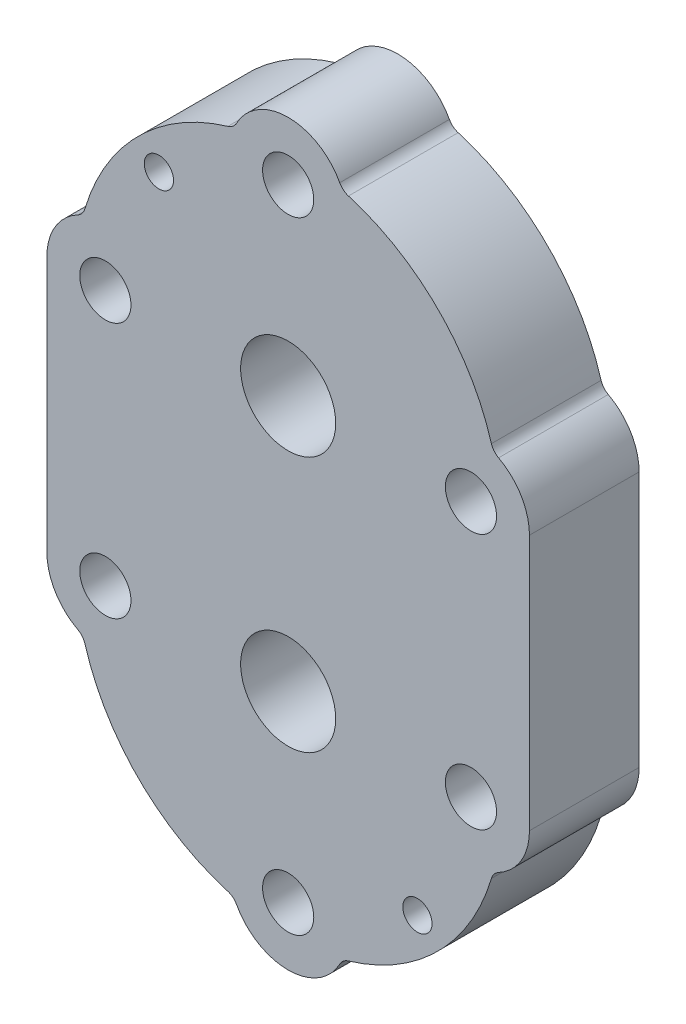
SolidWorks part; units mm, degrees
ref_plane "前视基准面" through (0, 0, 0) normal (0, 0, 1) x (1, 0, 0)
ref_plane "上视基准面" through (0, 0, 0) normal (0, 1, 0) x (1, 0, 0)
ref_plane "右视基准面" through (0, 0, 0) normal (1, 0, 0) x (0, 0, -1)
sketch "草图1" plane through (0, 0, 0) normal (0, 0, 1) x (1, 0, 0)
  line L0 (0, 0) -> (0, -35) construction
  line L1 (29, 0) -> (29, -35)
  line L2 (-29, 0) -> (-29, -35)
  arc A0 (29, 0) -> (-29, 0) centre (0, 0) ccw
  arc A1 (-29, -35) -> (29, -35) centre (0, -35) ccw
  point P3 (0, -17.5)
  dimension "D2" = 29
  dimension "D1" = 35
extrude "凸台-拉伸1" add sketch "草图1" along normal blind 15
sketch "草图2" plane through (0, 0, 0) normal (0, 0, -1) x (-1, 0, 0)
  line L0 (0, -35) -> (0, 0) construction
  line L1 (-25, -35) -> (-25, 0) construction
  line L2 (-29, 0) -> (-29, -35)
  line L3 (29, -35) -> (29, 0)
  line L4 (-29, 0) -> (-29, -35)
  line L5 (29, -35) -> (29, 0)
  line L6 (25, -35) -> (25, 0) construction
  line L7 (-33, -35) -> (-33, 0)
  line L8 (33, 0) -> (33, -35)
  arc A0 (-25, -35) -> (25, -35) centre (0, -35) ccw construction
  arc A1 (25, 0) -> (-25, 0) centre (0, 0) ccw construction
  arc A2 (-29, -35) -> (29, -35) centre (0, -35) ccw
  arc A3 (29, 0) -> (-29, 0) centre (0, 0) ccw
  arc A4 (-29, -35) -> (-28.04, -42.3999) centre (0, -35) ccw
  arc A5 (29, 0) -> (28.04, 7.3999) centre (0, 0) ccw
  arc A6 (-7.3999, -63.04) -> (7.3999, -63.04) centre (0, -60) ccw
  arc A7 (-33, -35) -> (-28.04, -42.3999) centre (-25, -35) ccw
  arc A8 (-28.04, 7.3999) -> (-33, 0) centre (-25, 0) ccw
  arc A9 (7.3999, 28.04) -> (-7.3999, 28.04) centre (0, 25) ccw
  arc A10 (33, 0) -> (28.04, 7.3999) centre (25, 0) ccw
  arc A11 (28.04, -42.3999) -> (33, -35) centre (25, -35) ccw
  arc A12 (28.04, -42.3999) -> (29, -35) centre (0, -35) ccw
  arc A13 (-7.3999, -63.04) -> (7.3999, -63.04) centre (0, -35) ccw
  arc A14 (-28.04, 7.3999) -> (-29, 0) centre (0, 0) ccw
  arc A15 (7.3999, 28.04) -> (-7.3999, 28.04) centre (0, 0) ccw
  point P2 (0, -17.5)
  point P25 (-33, 0)
  point P30 (-33, -35)
  point P33 (33, -35)
  point P34 (33, 0)
  point P37 (0, 0)
  dimension "D2" = 25
  dimension "D3" = 16
  dimension "D4" = 16
  dimension "D5" = 16
  dimension "D6" = 16
  dimension "D7" = 16
  dimension "D8" = 16
  dimension "D1" = 0
extrude "凸台-拉伸2" add sketch "草图2" against normal up to surface (15 mm away)
fillet "圆角1" radius 2 8 edges at (-28.04, 7.3999, 7.5) (-28.04, -42.3999, 7.5) (7.3999, -63.04, 7.5) (-7.3999, -63.04, 7.5) (28.04, -42.3999, 7.5) (28.04, 7.3999, 7.5) (-7.3999, 28.04, 7.5) (7.3999, 28.04, 7.5)
sketch "草图3" plane through (0, 0, 0) normal (0, 0, -1) x (-1, 0, 0)
  line L0 (0, 0) -> (0, -35) construction
  line L1 (14, 0) -> (14, -35)
  line L2 (-14, 0) -> (-14, -35)
  arc A0 (14, 0) -> (-14, 0) centre (0, 0) ccw
  arc A1 (-14, -35) -> (14, -35) centre (0, -35) ccw
  point P4 (0, -17.5)
  dimension "D1" = 14
extrude "凸台-拉伸3" add sketch "草图3" along normal blind 7
fillet "圆角2" radius 2 8 edges at (0, -49, 0) (14, -17.5, 0) (0, 14, 0) (-14, -17.5, 0) (14, -17.5, -7) (0, 14, -7) (-14, -17.5, -7) (0, -49, -7)
sketch "草图4" plane through (0, 0, 15) normal (0, 0, 1) x (1, 0, 0)
  line L0 (0, 0) -> (0, -35) construction
  line L1 (25, 0) -> (25, -35) construction
  line L2 (-25, 0) -> (-25, -35) construction
  line L3 (17.6777, -52.6777) -> (0, -35)
  line L4 (-17.6777, 17.6777) -> (0, 0)
  arc A0 (25, 0) -> (-25, 0) centre (0, 0) ccw construction
  arc A1 (-25, -35) -> (25, -35) centre (0, -35) ccw construction
  circle A2 centre (0, -60) radius 3.5
  circle A3 centre (25, -35) radius 3.5
  circle A4 centre (25, 0) radius 3.5
  circle A5 centre (-25, 0) radius 3.5
  circle A6 centre (0, 25) radius 3.5
  circle A7 centre (-25, -35) radius 3.5
  circle A8 centre (-17.6777, 17.6777) radius 2
  circle A9 centre (17.6777, -52.6777) radius 2
  point P4 (0, -17.5)
  point P26 (0, 0)
  dimension "D1" = 25
  dimension "D2" = 7
  dimension "D3" = 7
  dimension "D4" = 7
  dimension "D5" = 7
  dimension "D6" = 7
  dimension "D7" = 7
  dimension "D10" = 4
  dimension "D11" = 4
  dimension "D8" = 135
  dimension "D9" = 135
extrude "切除-拉伸1" cut sketch "草图4" against normal up to surface (15 mm away)
sketch "草图5" plane through (0, 0, 0) normal (0, 0, -1) x (-1, 0, 0)
  circle A0 centre (0, -60) radius 5.5
  circle A1 centre (-25, -35) radius 5.5
  circle A2 centre (-25, 0) radius 5.5
  circle A3 centre (25, -35) radius 5.5
  circle A4 centre (25, 0) radius 5.5
  circle A5 centre (0, 25) radius 5.5
  dimension "D1" = 11
  dimension "D2" = 11
  dimension "D3" = 11
  dimension "D4" = 11
  dimension "D5" = 11
  dimension "D6" = 11
extrude "切除-拉伸2" cut sketch "草图5" against normal blind 4
sketch "草图6" plane through (0, 0, 15) normal (0, 0, 1) x (1, 0, 0)
  circle A0 centre (0, -35) radius 6.5
  circle A1 centre (0, 0) radius 6.5
  dimension "D1" = 13
  dimension "D2" = 13
extrude "切除-拉伸3" cut sketch "草图6" against normal blind 15
sketch "草图8" plane through (0, 0, 0) normal (1, 0, 0) x (0, 0, -1)
  line L0 (0, -28.5) -> (0, -41.5) construction
  line L1 (0, -28.5) -> (0, -41.5) construction
  line L2 (0, -41.5) -> (3.7528, -35)
  line L3 (-15, -35) -> (0, -35) construction
  line L5 (3.7528, -35) -> (0, -35)
  line L6 (0, -35) -> (0, -41.5)
  dimension "D1" = 30
revolve "切除-旋转4" cut sketch "草图8" angle 360 about L5
sketch "草图9" plane through (0, 0, 0) normal (1, 0, 0) x (0, 0, -1)
  line L0 (0, 6.5) -> (0, -6.5) construction
  line L1 (0, 6.5) -> (0, -6.5) construction
  line L2 (0, -6.5) -> (0, 0)
  line L3 (0, 0) -> (3.7528, 0)
  line L4 (3.7528, 0) -> (0, -6.5)
  point P2 (0, 0)
  dimension "D1" = 30
revolve "切除-旋转5" cut sketch "草图9" angle 360 about L3
